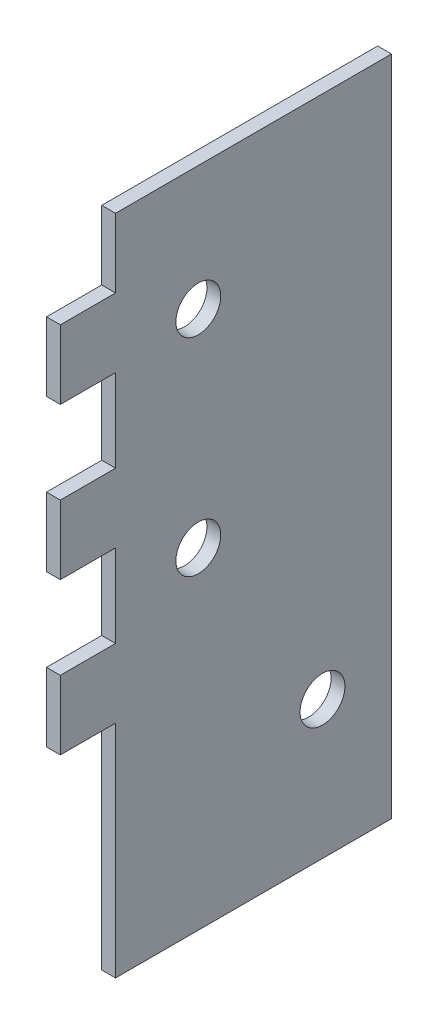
SolidWorks part; units mm, degrees
ref_plane "Front Plane" through (0, 0, 0) normal (0, 0, 1) x (1, 0, 0)
ref_plane "Top Plane" through (0, 0, 0) normal (0, 1, 0) x (1, 0, 0)
ref_plane "Right Plane" through (0, 0, 0) normal (1, 0, 0) x (0, 0, -1)
sketch "Sketch1" plane through (0, 0, 0) normal (0, 1, 0) x (1, 0, 0)
  line L1 (-3.175, 63.5) -> (3.175, 63.5)
  line L2 (-3.175, 63.5) -> (-3.175, -63.5)
  line L3 (-3.175, -63.5) -> (3.175, -63.5)
  line L4 (3.175, 63.5) -> (3.175, -63.5)
  line L5 (-3.175, 63.5) -> (3.175, -63.5) construction
  line L6 (-3.175, -63.5) -> (3.175, 63.5) construction
  point P0 (0, 0)
  dimension "D1" = 127
  dimension "D2" = 6.35
extrude "Boss-Extrude1" add sketch "Sketch1" along normal blind 304.8
sketch "Sketch2" plane through (3.175, 0, 0) normal (1, 0, 0) x (0, 0, -1)
  line L0 (-63.5, 304.8) -> (-63.5, 0) construction
  line L1 (-63.5, 304.8) -> (63.5, 304.8) construction
  line L2 (-63.5, 0) -> (63.5, 0) construction
  circle A0 centre (-25.4, 247.65) radius 10.3187
  circle A1 centre (-25.4, 152.4) radius 10.3187
  circle A2 centre (31.75, 63.5) radius 10.3188
  dimension "D1" = 20.6375
  dimension "D2" = 38.1
  dimension "D3" = 152.4
  dimension "D4" = 95.25
  dimension "D5" = 63.5
  dimension "D6" = 95.25
extrude "Cut-Extrude1" cut sketch "Sketch2" against normal blind 304.8
sketch "Sketch3" plane through (0, 0, 63.5) normal (0, 0, 1) x (1, 0, 0)
  line L0 (-3.175, 304.8) -> (-3.175, 0) construction
  line L1 (-3.175, 273.05) -> (3.175, 273.05)
  line L2 (-3.175, 273.05) -> (-3.175, 241.3)
  line L3 (-3.175, 241.3) -> (3.175, 241.3)
  line L4 (3.175, 273.05) -> (3.175, 241.3)
  line L5 (3.175, 304.8) -> (3.175, 0) construction
  line L6 (-3.175, 304.8) -> (3.175, 304.8) construction
  line L7 (-3.175, 203.2) -> (3.175, 203.2)
  line L8 (-3.175, 203.2) -> (-3.175, 171.45)
  line L9 (-3.175, 171.45) -> (3.175, 171.45)
  line L10 (3.175, 203.2) -> (3.175, 171.45)
  line L11 (-3.175, 133.35) -> (3.175, 133.35)
  line L12 (-3.175, 133.35) -> (-3.175, 101.6)
  line L13 (-3.175, 101.6) -> (3.175, 101.6)
  line L14 (3.175, 133.35) -> (3.175, 101.6)
  point P18 (0, 241.3)
  dimension "D1" = 31.75
  dimension "D2" = 31.75
  dimension "D3" = 38.1
  dimension "D4" = 31.75
  dimension "D5" = 38.1
  dimension "D6" = 31.75
extrude "Boss-Extrude2" add sketch "Sketch3" along normal blind 25.4
